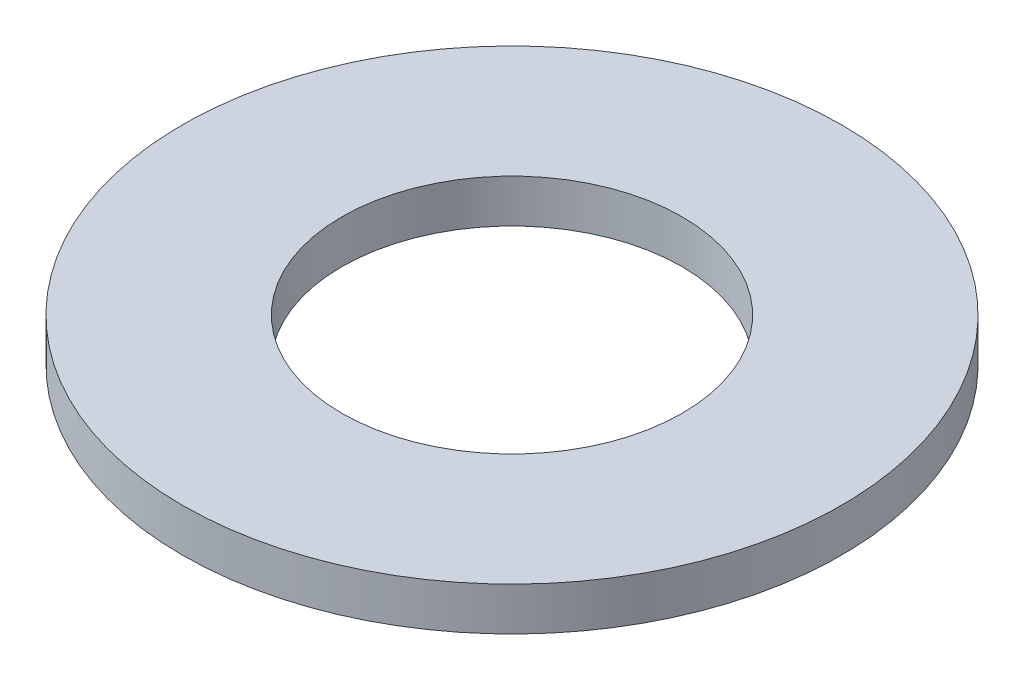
SolidWorks part; units mm, degrees
ref_plane "Face" through (0, 0, 0) normal (0, 0, 1) x (1, 0, 0)
ref_plane "Dessus" through (0, 0, 0) normal (0, 1, 0) x (1, 0, 0)
ref_plane "Côté" through (0, 0, 0) normal (1, 0, 0) x (0, 0, -1)
sketch "Esquisse1" plane through (0, 0, 0) normal (0, 0, 1) x (1, 0, 0)
  line L0 (0, -3.8311) -> (0, 19.1557) construction
  line L2 (-61, 8) -> (-31.5, 8)
  line L3 (-61, 8) -> (-61, 0)
  line L4 (-61, 0) -> (-31.5, 0)
  line L5 (-31.5, 8) -> (-31.5, 0)
  dimension "D1" = 122
  dimension "D2" = 63
  dimension "D3" = 8
revolve "Base-Révolution" add sketch "Esquisse1" angle 360 about L0
sketch "Esquisse2" [suppressed] plane through (0, 0, 0) normal (0, 0, 1) x (1, 0, 0)
  line L0 (-47.3292, 8) -> (-47.1, 6.7)
  line L1 (61.25, 8) -> (-61.25, 8) construction
  line L2 (-47.1, 6.7) -> (-46.35, 6.7)
  line L3 (-46.35, 6.7) -> (-46.1208, 8)
  line L4 (-46.1208, 8) -> (-47.3292, 8)
  line L5 (0, -7.7151) -> (0, 16.7741) construction
  line L6 (-46.35, 6.7) -> (-46.35, 9.9282) construction
  line L7 (-55.5, 0) -> (-55.5, 0.9) construction
  line L8 (-55.5, 0.9) -> (-52.5, 0.9) construction
  line L9 (-61.25, 0) -> (61.25, 0) construction
  line L10 (-54.6424, 0) -> (0, 0)
  line L11 (0, 0) -> (0, 0.9)
  line L12 (0, 0.9) -> (-52.5, 0.9)
  line L13 (-55.5, 0) -> (-54.6424, 0) construction
  arc A0 (-52.5, 0.9) -> (-54.6424, 0) centre (-52.5, -2.1) ccw
  dimension "D8" = 6
  dimension "D1" = 1.3
  dimension "D2" = 10
  dimension "D3" = 20
  dimension "D4" = 0.75
  dimension "D5" = 92.7
  dimension "D6" = 55.5
  dimension "D7" = 0.9
revolve "Gorge" [suppressed] cut sketch "Esquisse2" angle 360 about L5
